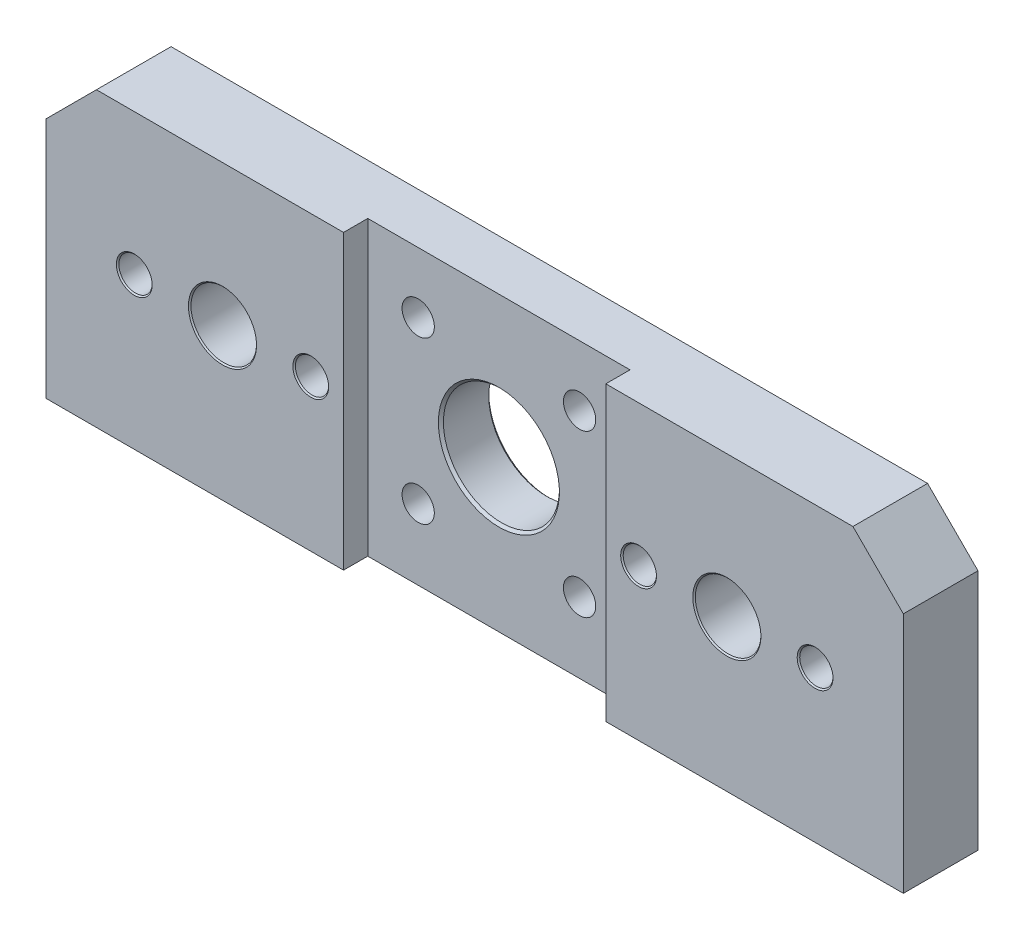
SolidWorks part; units mm, degrees
ref_plane "Face" through (0, 0, 0) normal (0, 0, 1) x (1, 0, 0)
ref_plane "Dessus" through (0, 0, 0) normal (0, 1, 0) x (1, 0, 0)
ref_plane "Droite" through (0, 0, 0) normal (1, 0, 0) x (0, 0, -1)
sketch "Esquisse1" plane through (0, 0, 0) normal (0, 0, 1) x (1, 0, 0)
  line L1 (-85, 0) -> (85, 0)
  line L2 (-85, 0) -> (-85, 58)
  line L3 (-85, 58) -> (85, 58)
  line L4 (85, 0) -> (85, 58)
  dimension "D1" = 170
  dimension "D2" = 85
  dimension "D3" = 58
extrude "Extrusion1" add sketch "Esquisse1" along normal blind 14.8
chamfer "Chanfrein1" distance 10 angle 45 2 edges at (-85, 58, 7.4) (85, 58, 7.4)
sketch "Esquisse2" plane through (0, 0, 14.8) normal (0, 0, 1) x (1, 0, 0)
  line L0 (-85, 0) -> (85, 0) construction
  line L1 (-26, 0) -> (26, 0)
  line L2 (-26, 0) -> (-26, 84.0865)
  line L3 (-26, 84.0865) -> (26, 84.0865)
  line L4 (26, 0) -> (26, 84.0865)
  dimension "D1" = 52
  dimension "D2" = 26
extrude "Enlèv. mat.-Extru.1" cut sketch "Esquisse2" against normal blind 4.8
sketch "Esquisse3" plane through (0, 0, 14.8) normal (0, 0, 1) x (1, 0, 0)
  line L0 (-85.5821, 30) -> (104.2738, 30) construction
  line L1 (0, 0) -> (0, 67.0027) construction
  line L2 (-26, 58) -> (-75, 58) construction
  circle A0 centre (0, 30) radius 11.5
  circle A1 centre (-50, 30) radius 6.5
  circle A2 centre (50, 30) radius 6.5
  dimension "D1" = 23
  dimension "D2" = 13
  dimension "D3" = 100
  dimension "D4" = 50
  dimension "D5" = 28
extrude "Enlèv. mat.-Extru.2" cut sketch "Esquisse3" against normal through all
hole_wizard "Chambrage pour vis à tête cylindrique à 6 pans creux (vis CHC) M61" positions "Esquisse5" profile "Esquisse4" counterbore size "M6" standard "ISO"
sketch "Esquisse5" plane through (0, 0, 0) normal (0, 0, -1) x (-1, 0, 0)
  line L0 (0, 30) -> (100.2465, 30) construction
  line L1 (0, 30) -> (-98.3125, 30) construction
  circle A0 centre (-50, 30) radius 6.5 construction
  circle A1 centre (50, 30) radius 6.5 construction
  point P0 (-32.5, 30)
  point P1 (-67.5, 30)
  point P2 (32.5, 30)
  point P3 (67.5, 30)
  dimension "D1" = 35
  dimension "D2" = 35
  dimension "D3" = 17.5
  dimension "D4" = 17.5
sketch "Esquisse4" plane through (32.5, 30, 0) normal (1, 0, 0) x (0, 1, 0)
  line L0 (0, 0) -> (0, 14.8)
  line L1 (0, 14.8) -> (3.3, 14.8)
  line L3 (3.3, 14.8) -> (3.3, 7)
  line L4 (3.3, 7) -> (6, 7)
  line L5 (6, 7) -> (6, 0)
  line L7 (6, 0) -> (0, 0)
  line L11 (0, -6.35) -> (0, 107.95) construction
  dimension "Diamètre du perçage jusqu'au prochain" = 6.6
  dimension "Profondeur du perçage jusqu'au prochain" = 14.8
  dimension "Diamètre du chambrage" = 12
  dimension "Profondeur du chambrage" = 7
chamfer "Chanfrein2" distance 0.5 angle 45 2 edges at (11.5, 30, 0) (-11.5, 30, 10)
chamfer "Chanfrein3" distance 0.25 angle 45 12 edges at (61.5, 30, 0) (56.5, 30, 0) (26.5, 30, 0) (-38.5, 30, 0) (-43.5, 30, 0) (-73.5, 30, 0) (-70.8, 30, 14.8) (-43.5, 30, 14.8) (-35.8, 30, 14.8) (29.2, 30, 14.8) (56.5, 30, 14.8) (64.2, 30, 14.8)
hole_wizard "Trou taraudé M61" positions "Esquisse7" profile "Esquisse6" tap size "M6" standard "ISO"
sketch "Esquisse7" plane through (0, 0, 0) normal (0, -1, 0) x (1, 0, 0)
  line L0 (89.9317, 7.5) -> (-95.0891, 7.5) construction
  line L1 (-85, 0) -> (85, 0) construction
  line L2 (85, 14.8) -> (85, 0) construction
  line L3 (-85, 14.8) -> (-85, 0) construction
  point P0 (73, 7.5)
  point P1 (-73, 7.5)
  dimension "D1" = 7.5
  dimension "D2" = 12
  dimension "D3" = 12
sketch "Esquisse6" plane through (73, 0, 7.5) normal (1, 0, 0) x (0, 0, -1)
  line L0 (0, 0) -> (0, 23.4421)
  line L1 (0, 23.4421) -> (2.4, 22)
  line L2 (2.4, 22) -> (2.4, 0)
  line L5 (2.4, 0) -> (0, 0)
  line L10 (0, 23.4421) -> (-2.4, 22) construction
  line L11 (0, -6.35) -> (0, 107.95) construction
  dimension "Diamètre du trou pour taraudage" = 4.8
  dimension "Profondeur du trou pour taraudage" = 22
  dimension "Angle de pointe" = 118
hole_wizard "Dégagement M62" positions "Esquisse12" profile "Esquisse11" hole size "M6" standard "ISO"
sketch "Esquisse12" plane through (0, 0, 10) normal (0, 0, 1) x (1, 0, 0)
  line L0 (0, 30) -> (0, 107.0505) construction
  line L2 (0, 30) -> (-144.7305, 30) construction
  point P0 (16, 46)
  point P1 (16, 14)
  point P3 (-16, 46)
  point P5 (-16, 14)
  dimension "D1" = 32
  dimension "D2" = 32
sketch "Esquisse11" plane through (16, 46, 10) normal (1, 0, 0) x (0, -1, 0)
  line L0 (0, 0) -> (0, 11.9228)
  line L1 (0, 11.9228) -> (3.2, 10)
  line L2 (3.2, 10) -> (3.2, 0)
  line L5 (3.2, 0) -> (0, 0)
  line L10 (0, 11.9228) -> (-3.2, 10) construction
  line L11 (0, -6.35) -> (0, 107.95) construction
  dimension "Diamètre du perçage" = 6.4
  dimension "Profondeur du perçage" = 10
  dimension "Angle de pointe" = 118
